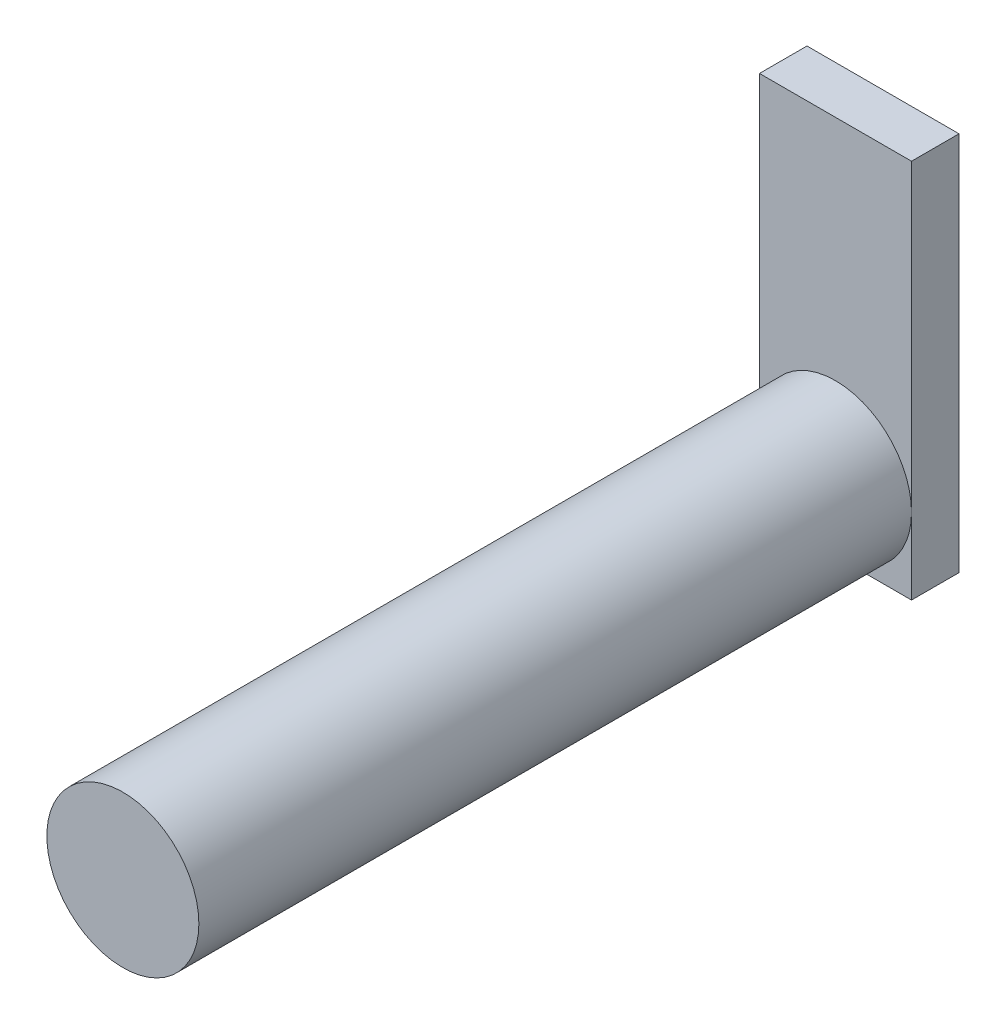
SolidWorks part; units mm, degrees
ref_plane "Plan de face" through (0, 0, 0) normal (0, 0, 1) x (1, 0, 0)
ref_plane "Plan de dessus" through (0, 0, 0) normal (0, 1, 0) x (1, 0, 0)
ref_plane "Plan de droite" through (0, 0, 0) normal (1, 0, 0) x (0, 0, -1)
sketch "Esquisse1" plane through (0, 0, 0) normal (0, 0, 1) x (1, 0, 0)
  circle A0 centre (0, 0) radius 16
extrude "Boss.-Extru.1" add sketch "Esquisse1" along normal blind 150
sketch "Esquisse2" plane through (0, 0, 0) normal (0, 0, -1) x (-1, 0, 0)
  line L1 (-16, -16) -> (16, -16)
  line L2 (-16, -16) -> (-16, 64)
  line L3 (-16, 64) -> (16, 64)
  line L4 (16, -16) -> (16, 64)
  dimension "D1" = 32
  dimension "D2" = 16
  dimension "D3" = 80
  dimension "D4" = 16
extrude "Boss.-Extru.2" add sketch "Esquisse2" along normal blind 10
ref_plane "Plan1" through (0, 0, 10) normal (0, 0, 1) x (1, 0, 0)
sketch "Esquisse3" plane through (0, 0, 10) normal (0, 0, 1) x (1, 0, 0)
  circle A0 centre (0, 0) radius 22
sketch "Esquisse4" plane through (0, 0, 0) normal (1, 0, 0) x (0, 0, -1)
  line L0 (-165.068, 0) -> (31.499, 0)
  line L1 (-150, 16) -> (-150, -16) construction
  point P3 (-150, 0)
